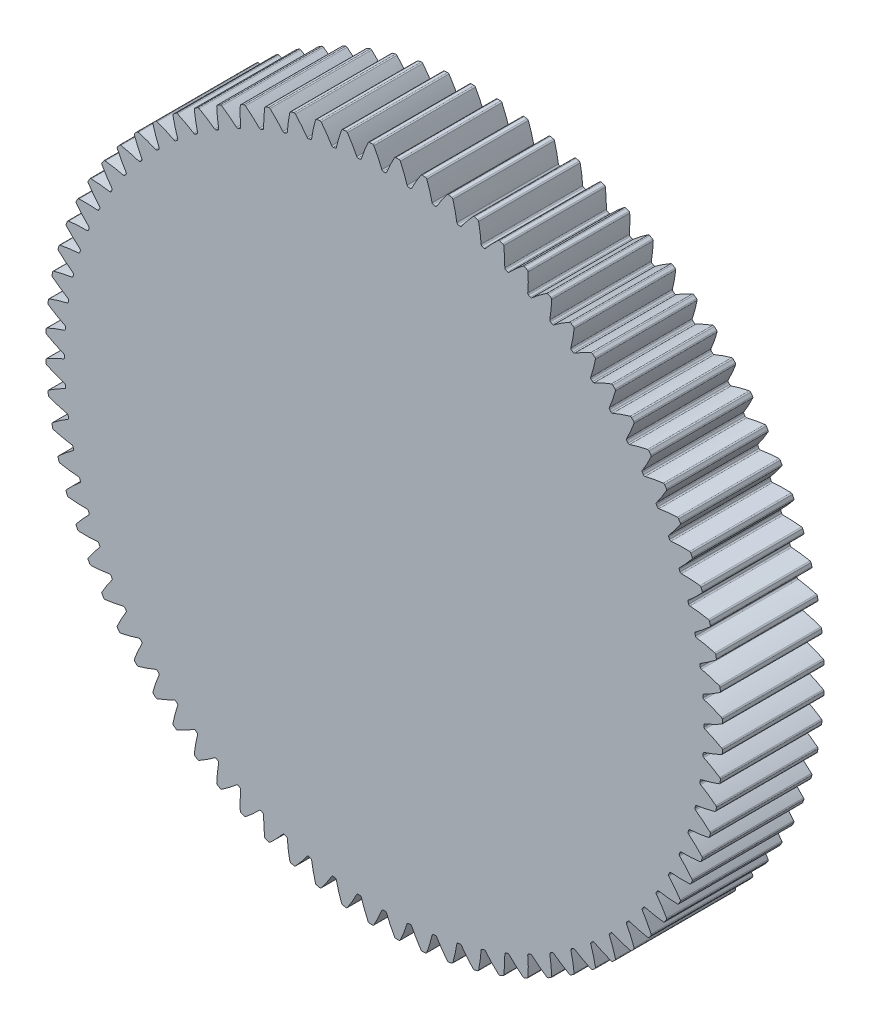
SolidWorks part; units mm, degrees
ref_plane "Front" through (0, 0, 0) normal (0, 0, 1) x (1, 0, 0)
ref_plane "Top" through (0, 0, 0) normal (0, 1, 0) x (1, 0, 0)
ref_plane "Right" through (0, 0, 0) normal (1, 0, 0) x (0, 0, -1)
sketch "Sketch1" plane through (0, 0, 0) normal (0, 0, 1) x (1, 0, 0)
  circle A0 centre (0, 0) radius 42.3069
extrude "Boss-Extrude1" add sketch "Sketch1" along normal blind 12.7
sketch "Sketch3" plane through (0, 0, 0) normal (0, 0, 1) x (1, 0, 0)
  line L0 (0, 0) -> (43.7181, 0) construction
  line L2 (0, 0) -> (0.4135, 39.983) construction
  line L3 (0, 0) -> (-0.4135, 39.983) construction
  line L4 (-0.4135, 39.983) -> (-0.3868, 37.4059) construction
  line L5 (0, 0) -> (0, 61.276) construction
  line L6 (0.4135, 39.983) -> (0.3868, 37.4059) construction
  circle A0 centre (0, 0) radius 42.3069 construction
  circle A1 centre (0, 0) radius 41.275 construction
  circle A2 centre (0, 0) radius 37.4079 construction
  arc A3 (-0.4135, 39.983) -> (0.4135, 39.983) centre (0, 0) ccw construction
  arc A5 (1.3504, 42.2853) -> (-1.3504, 42.2853) centre (0, 0) ccw
  spline S0 degree 4 poles (0.3868, 37.4059) (0.3868, 37.4136) (0.3865, 37.4352) (0.3849, 37.4762) (0.3808, 37.5429) (0.3734, 37.628) (0.3613, 37.7379) (0.3437, 37.8673) (0.321, 38.0094) (0.2927, 38.1638) (0.2611, 38.3177) (0.2266, 38.4711) (0.1895, 38.6237) (0.1414, 38.8083) (0.0791, 39.0294) (-0.0001, 39.2873) (-0.0977, 39.5791) (-0.2054, 39.8758) (-0.3181, 40.167) (-0.4397, 40.4603) (-0.5629, 40.7436) (-0.6987, 41.0368) (-0.8281, 41.307) (-0.9819, 41.6086) (-1.1086, 41.8517) (-1.2849, 42.1709) (-1.3919, 42.3591) (-1.5203, 42.5789) (-1.579, 42.6762) (-1.6151, 42.7361) knots 0 0 0 0 0 0.005377 0.015084 0.028532 0.04661 0.064855 0.092111 0.119476 0.146842 0.174209 0.201575 0.228941 0.256307 0.307035 0.361767 0.4165 0.471232 0.525964 0.580697 0.635429 0.690161 0.744894 0.799626 0.854358 0.909091 0.954545 1 1 1 1 1 construction
  spline S1 degree 4 poles (0.3868, 37.4059) (0.3868, 37.4136) (0.3865, 37.4352) (0.3849, 37.4762) (0.3808, 37.5429) (0.3734, 37.628) (0.3613, 37.7379) (0.3437, 37.8673) (0.321, 38.0094) (0.2927, 38.1638) (0.2611, 38.3177) (0.2266, 38.4711) (0.1895, 38.6237) (0.1414, 38.8083) (0.0791, 39.0294) (-0.0001, 39.2873) (-0.0977, 39.5791) (-0.2054, 39.8758) (-0.3181, 40.167) (-0.4397, 40.4603) (-0.5629, 40.7436) (-0.6987, 41.0368) (-0.8281, 41.307) (-0.9819, 41.6086) (-1.1086, 41.8517) (-1.2467, 42.1017) (-1.315, 42.2233) (-1.3504, 42.2853) knots 0 0 0 0 0 0.005377 0.015084 0.028532 0.04661 0.064855 0.092111 0.119476 0.146842 0.174209 0.201575 0.228941 0.256307 0.307035 0.361767 0.4165 0.471232 0.525964 0.580697 0.635429 0.690161 0.744894 0.799626 0.854358 0.909091 0.909091 0.909091 0.909091 0.909091
  spline S2 degree 4 poles (-0.3868, 37.4059) (-0.3868, 37.4136) (-0.3865, 37.4352) (-0.3849, 37.4762) (-0.3808, 37.5429) (-0.3734, 37.628) (-0.3613, 37.7379) (-0.3437, 37.8673) (-0.321, 38.0094) (-0.2927, 38.1638) (-0.2611, 38.3177) (-0.2266, 38.4711) (-0.1895, 38.6237) (-0.1414, 38.8083) (-0.0791, 39.0294) (0.0001, 39.2873) (0.0977, 39.5791) (0.2054, 39.8758) (0.3181, 40.167) (0.4397, 40.4603) (0.5629, 40.7436) (0.6987, 41.0368) (0.8281, 41.307) (0.9819, 41.6086) (1.1086, 41.8517) (1.2849, 42.1709) (1.3919, 42.3591) (1.5203, 42.5789) (1.579, 42.6762) (1.6151, 42.7361) knots 0 0 0 0 0 0.005377 0.015084 0.028532 0.04661 0.064855 0.092111 0.119476 0.146842 0.174209 0.201575 0.228941 0.256307 0.307035 0.361767 0.4165 0.471232 0.525964 0.580697 0.635429 0.690161 0.744894 0.799626 0.854358 0.909091 0.954545 1 1 1 1 1 construction
  spline S3 degree 4 poles (-0.3868, 37.4059) (-0.3868, 37.4136) (-0.3865, 37.4352) (-0.3849, 37.4762) (-0.3808, 37.5429) (-0.3734, 37.628) (-0.3613, 37.7379) (-0.3437, 37.8673) (-0.321, 38.0094) (-0.2927, 38.1638) (-0.2611, 38.3177) (-0.2266, 38.4711) (-0.1895, 38.6237) (-0.1414, 38.8083) (-0.0791, 39.0294) (0.0001, 39.2873) (0.0977, 39.5791) (0.2054, 39.8758) (0.3181, 40.167) (0.4397, 40.4603) (0.5629, 40.7436) (0.6987, 41.0368) (0.8281, 41.307) (0.9819, 41.6086) (1.1086, 41.8517) (1.2467, 42.1017) (1.315, 42.2233) (1.3504, 42.2853) knots 0 0 0 0 0 0.005377 0.015084 0.028532 0.04661 0.064855 0.092111 0.119476 0.146842 0.174209 0.201575 0.228941 0.256307 0.307035 0.361767 0.4165 0.471232 0.525964 0.580697 0.635429 0.690161 0.744894 0.799626 0.854358 0.909091 0.909091 0.909091 0.909091 0.909091
  point P0 (0, -39.9852)
sketch "DCLTBC" [suppressed] plane through (0, 0, 0) normal (0, 0, 1) x (1, 0, 0)
  line L0 (0, 0) -> (41.04, 0) construction
  line L1 (-16.5988, 341.5199) -> (-17.1927, 353.7396) construction
  line L2 (16.5988, 341.5199) -> (17.1927, 353.7396) construction
  line L3 (-16.5988, 341.5199) -> (-17.1927, 353.7396)
  line L4 (16.5988, 341.5199) -> (17.1927, 353.7396)
  line L5 (0, 0) -> (0, 104.9356) construction
  circle A0 centre (0, 0) radius 429.8462
  circle A1 centre (0, 0) radius 390.7692 construction
  circle A2 centre (0, 0) radius 354.1572 construction
  arc A3 (16.5988, 341.5199) -> (-16.5988, 341.5199) centre (0, 0) ccw construction
  arc A4 (16.5988, 341.5199) -> (-16.5988, 341.5199) centre (0, 0) ccw
  spline S0 degree 4 poles (-1014.6631, 283.0439) (-47.6852, 335.8844) (-17.293, 343.3327) (-16.5403, 349.5311) (-17.4538, 355.9262) (-17.693, 357.2758) (-18.0546, 359.0133) (-18.5477, 361.0502) (-19.1599, 363.2771) (-19.9008, 365.6854) (-20.7071, 368.0753) (-21.5719, 370.4445) (-22.4903, 372.7935) (-23.665, 375.6195) (-25.1689, 378.9903) (-27.0474, 382.8826) (-29.347, 387.2688) (-31.8293, 391.6605) (-34.4404, 395.9766) (-36.8296, 399.688) (-38.9472, 402.8229) (-40.7561, 405.4047) (-42.229, 407.452) (-44.1012, 409.9882) (-46.0141, 412.4944) (-47.9652, 414.9702) (-49.954, 417.4168) (-51.5659, 419.3552) (-52.9965, 421.0377) (-54.2324, 422.4653) (-55.2776, 423.6552) (-58.4723, 427.2561) (-63.5875, 432.7944) (-33.3353, 399.1791) (-729.2796, 1166.5662) knots -0.233759 -0.233759 -0.233759 -0.233759 -0.233759 0.005377 0.015084 0.028532 0.04661 0.064855 0.092111 0.119476 0.146842 0.174209 0.201575 0.228941 0.256307 0.307035 0.361767 0.4165 0.471232 0.525964 0.580697 0.608063 0.635429 0.662795 0.690161 0.744894 0.77226 0.799626 0.826992 0.854358 0.868042 0.881725 0.895408 1.068789 1.068789 1.068789 1.068789 1.068789 only from (-17.1927, 353.7396) to (-57.3769, 425.9995) construction
  spline S1 degree 4 poles (1014.6631, 283.0439) (47.6852, 335.8844) (17.293, 343.3327) (16.5403, 349.5311) (17.4538, 355.9262) (17.693, 357.2758) (18.0546, 359.0133) (18.5477, 361.0502) (19.1599, 363.2771) (19.9008, 365.6854) (20.7071, 368.0753) (21.5719, 370.4445) (22.4903, 372.7935) (23.665, 375.6195) (25.1689, 378.9903) (27.0474, 382.8826) (29.347, 387.2688) (31.8293, 391.6605) (34.4404, 395.9766) (36.8296, 399.688) (38.9472, 402.8229) (40.7561, 405.4047) (42.229, 407.452) (44.1012, 409.9882) (46.0141, 412.4944) (47.9652, 414.9702) (49.954, 417.4168) (51.5659, 419.3552) (52.9965, 421.0377) (54.2324, 422.4653) (55.2776, 423.6552) (58.4723, 427.2561) (63.5875, 432.7944) (33.3353, 399.1791) (729.2796, 1166.5662) knots -0.233759 -0.233759 -0.233759 -0.233759 -0.233759 0.005377 0.015084 0.028532 0.04661 0.064855 0.092111 0.119476 0.146842 0.174209 0.201575 0.228941 0.256307 0.307035 0.361767 0.4165 0.471232 0.525964 0.580697 0.608063 0.635429 0.662795 0.690161 0.744894 0.77226 0.799626 0.826992 0.854358 0.868042 0.881725 0.895408 1.068789 1.068789 1.068789 1.068789 1.068789 only from (17.1927, 353.7396) to (57.3769, 425.9995) construction
  spline S2 degree 4 poles (-17.1927, 353.7396) (-17.2005, 353.8633) (-17.228, 354.2097) (-17.302, 354.863) (-17.4538, 355.9262) (-17.693, 357.2758) (-18.0546, 359.0133) (-18.5477, 361.0502) (-19.1599, 363.2771) (-19.9008, 365.6854) (-20.7071, 368.0753) (-21.5719, 370.4445) (-22.4903, 372.7935) (-23.665, 375.6195) (-25.1689, 378.9903) (-27.0474, 382.8826) (-29.347, 387.2688) (-31.8293, 391.6605) (-34.4404, 395.9766) (-36.8296, 399.688) (-38.9472, 402.8229) (-40.7561, 405.4047) (-42.229, 407.452) (-44.1012, 409.9882) (-46.0141, 412.4944) (-47.9652, 414.9702) (-49.954, 417.4168) (-51.5659, 419.3552) (-52.9965, 421.0377) (-54.2324, 422.4653) (-55.2776, 423.6552) (-56.0931, 424.5743) (-56.7935, 425.3543) (-57.1845, 425.7872) (-57.3769, 425.9995) knots 0 0 0 0 0 0.005377 0.015084 0.028532 0.04661 0.064855 0.092111 0.119476 0.146842 0.174209 0.201575 0.228941 0.256307 0.307035 0.361767 0.4165 0.471232 0.525964 0.580697 0.608063 0.635429 0.662795 0.690161 0.744894 0.77226 0.799626 0.826992 0.854358 0.868042 0.881725 0.895408 0.909091 0.909091 0.909091 0.909091 0.909091
  spline S3 degree 4 poles (17.1927, 353.7396) (17.2005, 353.8633) (17.228, 354.2097) (17.302, 354.863) (17.4538, 355.9262) (17.693, 357.2758) (18.0546, 359.0133) (18.5477, 361.0502) (19.1599, 363.2771) (19.9008, 365.6854) (20.7071, 368.0753) (21.5719, 370.4445) (22.4903, 372.7935) (23.665, 375.6195) (25.1689, 378.9903) (27.0474, 382.8826) (29.347, 387.2688) (31.8293, 391.6605) (34.4404, 395.9766) (36.8296, 399.688) (38.9472, 402.8229) (40.7561, 405.4047) (42.229, 407.452) (44.1012, 409.9882) (46.0141, 412.4944) (47.9652, 414.9702) (49.954, 417.4168) (51.5659, 419.3552) (52.9965, 421.0377) (54.2324, 422.4653) (55.2776, 423.6552) (56.0931, 424.5743) (56.7935, 425.3543) (57.1845, 425.7872) (57.3769, 425.9995) knots 0 0 0 0 0 0.005377 0.015084 0.028532 0.04661 0.064855 0.092111 0.119476 0.146842 0.174209 0.201575 0.228941 0.256307 0.307035 0.361767 0.4165 0.471232 0.525964 0.580697 0.608063 0.635429 0.662795 0.690161 0.744894 0.77226 0.799626 0.826992 0.854358 0.868042 0.881725 0.895408 0.909091 0.909091 0.909091 0.909091 0.909091
extrude "Cut-Extrude-DCLTBC" [suppressed] cut sketch "DCLTBC" along normal through all
fillet "Fillet-Tip-DCLTBC" [suppressed] radius 0.1835
fillet "Fillet-Root-DCLTBC" [suppressed] radius 0.367
pattern_circular "CirPattern-DCLTBC" [suppressed] count 80 over 360
sketch "DCGTBC" plane through (0, 0, 0) normal (0, 0, 1) x (1, 0, 0)
  line L0 (0, 0) -> (41.04, 0) construction
  line L1 (-39.833, 3.4849) -> (0, 0) construction
  line L2 (0, 0) -> (39.833, 3.4849) construction
  line L3 (0, 0) -> (-16.5124, 0)
  line L5 (0, 0) -> (0, 104.9356) construction
  circle A0 centre (0, 0) radius 42.3069
  circle A1 centre (0, 0) radius 41.275 construction
  circle A2 centre (0, 0) radius 37.4079 construction
  arc A3 (-0.4135, 39.983) -> (0.4135, 39.983) centre (0, 0) ccw construction
  arc A11 (39.833, 3.4849) -> (-39.833, 3.4849) centre (0, 0) ccw
  spline S4 degree 4 poles (999.5082, 24.1126) (13.6231, 35.3302) (-0.1447, 35.9376) (-0.4303, 36.7368) (-0.3808, 37.5429) (-0.3734, 37.628) (-0.3613, 37.7379) (-0.3437, 37.8673) (-0.321, 38.0094) (-0.2927, 38.1638) (-0.2611, 38.3177) (-0.2266, 38.4711) (-0.1895, 38.6237) (-0.1414, 38.8083) (-0.0791, 39.0294) (0.0001, 39.2873) (0.0977, 39.5791) (0.2054, 39.8758) (0.3181, 40.167) (0.4397, 40.4603) (0.5629, 40.7436) (0.6987, 41.0368) (0.8281, 41.307) (0.9819, 41.6086) (1.5374, 42.6745) (3.3727, 45.74) (-13.9019, 15.1174) (496.7932, 910.9139) knots -0.516008 -0.516008 -0.516008 -0.516008 -0.516008 0.005377 0.015084 0.028532 0.04661 0.064855 0.092111 0.119476 0.146842 0.174209 0.201575 0.228941 0.256307 0.307035 0.361767 0.4165 0.471232 0.525964 0.580697 0.635429 0.690161 0.744894 0.799626 0.854358 1.650265 1.650265 1.650265 1.650265 1.650265 only from (-0.3868, 37.4059) to (1.3504, 42.2853) construction
  spline S5 degree 4 poles (-999.5082, 24.1125) (-13.6231, 35.3302) (0.1447, 35.9376) (0.4303, 36.7368) (0.3808, 37.5429) (0.3734, 37.628) (0.3613, 37.7379) (0.3437, 37.8673) (0.321, 38.0094) (0.2927, 38.1638) (0.2611, 38.3177) (0.2266, 38.4711) (0.1895, 38.6237) (0.1414, 38.8083) (0.0791, 39.0294) (-0.0001, 39.2873) (-0.0977, 39.5791) (-0.2054, 39.8758) (-0.3181, 40.167) (-0.4397, 40.4603) (-0.5629, 40.7436) (-0.6987, 41.0368) (-0.8281, 41.307) (-0.9819, 41.6086) (-1.5374, 42.6745) (-3.3727, 45.74) (13.9019, 15.1174) (-496.7932, 910.9139) knots -0.516008 -0.516008 -0.516008 -0.516008 -0.516008 0.005377 0.015084 0.028532 0.04661 0.064855 0.092111 0.119476 0.146842 0.174209 0.201575 0.228941 0.256307 0.307035 0.361767 0.4165 0.471232 0.525964 0.580697 0.635429 0.690161 0.744894 0.799626 0.854358 1.650265 1.650265 1.650265 1.650265 1.650265 only from (0.3868, 37.4059) to (-1.3504, 42.2853) construction
  spline S6 degree 4 poles (-0.3868, 37.4059) (-0.3868, 37.4136) (-0.3865, 37.4352) (-0.3849, 37.4762) (-0.3808, 37.5429) (-0.3734, 37.628) (-0.3613, 37.7379) (-0.3437, 37.8673) (-0.321, 38.0094) (-0.2927, 38.1638) (-0.2611, 38.3177) (-0.2266, 38.4711) (-0.1895, 38.6237) (-0.1414, 38.8083) (-0.0791, 39.0294) (0.0001, 39.2873) (0.0977, 39.5791) (0.2054, 39.8758) (0.3181, 40.167) (0.4397, 40.4603) (0.5629, 40.7436) (0.6987, 41.0368) (0.8281, 41.307) (0.9819, 41.6086) (1.1086, 41.8517) (1.2467, 42.1017) (1.315, 42.2233) (1.3504, 42.2853) knots 0 0 0 0 0 0.005377 0.015084 0.028532 0.04661 0.064855 0.092111 0.119476 0.146842 0.174209 0.201575 0.228941 0.256307 0.307035 0.361767 0.4165 0.471232 0.525964 0.580697 0.635429 0.690161 0.744894 0.799626 0.854358 0.909091 0.909091 0.909091 0.909091 0.909091
  spline S7 degree 4 poles (0.3868, 37.4059) (0.3868, 37.4136) (0.3865, 37.4352) (0.3849, 37.4762) (0.3808, 37.5429) (0.3734, 37.628) (0.3613, 37.7379) (0.3437, 37.8673) (0.321, 38.0094) (0.2927, 38.1638) (0.2611, 38.3177) (0.2266, 38.4711) (0.1895, 38.6237) (0.1414, 38.8083) (0.0791, 39.0294) (-0.0001, 39.2873) (-0.0977, 39.5791) (-0.2054, 39.8758) (-0.3181, 40.167) (-0.4397, 40.4603) (-0.5629, 40.7436) (-0.6987, 41.0368) (-0.8281, 41.307) (-0.9819, 41.6086) (-1.1086, 41.8517) (-1.2467, 42.1017) (-1.315, 42.2233) (-1.3504, 42.2853) knots 0 0 0 0 0 0.005377 0.015084 0.028532 0.04661 0.064855 0.092111 0.119476 0.146842 0.174209 0.201575 0.228941 0.256307 0.307035 0.361767 0.4165 0.471232 0.525964 0.580697 0.635429 0.690161 0.744894 0.799626 0.854358 0.909091 0.909091 0.909091 0.909091 0.909091
  dimension "D1" = 5
  dimension "D2" = 5
extrude "Cut-Extrude-DCGTBC" cut sketch "DCGTBC" along normal through all
fillet "Fillet-Tip-DCGTBC" radius 0.1835 4 edges at (1.3504, 42.2853, 6.35) (-1.3504, 42.2853, 6.35) (0.2481, 39.9844, 6.35) (-0.2481, 39.9844, 6.35)
pattern_circular "CirPattern-DCGTBC" count 80 over 360 about axis through (0, 0, 12.7) along (0, 0, 1) of "Cut-Extrude-DCGTBC", "Fillet-Tip-DCGTBC"
equation "\"DiametralPitch\" = 80 / 3.25'Diametral Pitch"
equation "\"NumTeeth\"= 16 * 5'Number of Teeth"
equation "\"PressureAngle\"= 25deg'Pressure Angle"
equation "\"Addendum\"= 1 / \"DiametralPitch\"'Addendum"
equation "\"Dedendum\"= 1.25 / \"DiametralPitch\"'Dedendum"
equation "\"WorkingDepth\"= 2 / \"DiametralPitch\"'Working Depth - here for REF (Not used in building model)"
equation "\"WholeDepth\"= 2.25 / \"DiametralPitch\"'Whole Depth - here for REF (Not used in building model)"
equation "\"Clearance\"= .25 / \"DiametralPitch\"'Clearance"
equation "\"CircularPitch\"= pi / \"DiametralPitch\"'Circular Pitch - here for REF (Not used in building model)"
equation "\"PitchCircle\"= \"NumTeeth\" / \"DiametralPitch\"'Pitch Circle - or - Pitch Diameter"
equation "\"OutsideDiameter\"= ( \"NumTeeth\" + 2 ) / \"DiametralPitch\"'Outside Diameter"
equation "\"Fillet_Root\"= \"Clearance\" * cos ( \"PressureAngle\" ) * tan ( ( 90 + \"PressureAngle\" ) / 2 ) 'Fillet Root"
equation "\"AddendumCircle\"= \"PitchCircle\" + ( 2 * \"Addendum\" )'Addendum Circle - or - Addendum Diameter"
equation "\"DedendumCircle\"= \"PitchCircle\" - ( 2 * \"Dedendum\" )'Dedendum Circle - or - Dedendum Diameter"
equation "\"BaseCircle\"= \"PitchCircle\" * cos ( \"PressureAngle\" )'Base Circle - Base Diameter"
equation "\"PitchAngle\"= 360deg / \"NumTeeth\"'Pitch Angle"
equation "\"Alpha\"= sqr ( \"PitchCircle\" ^ 2 - \"BaseCircle\" ^ 2 ) / \"BaseCircle\" * 180 / PI - \"PressureAngle\"'Alpha - Used for Calculating Beta"
equation "\"Beta\"= ( \"PitchAngle\" / 4 - ( \"Alpha\" - 90 ) )'Beta - Used in definition of the parameters for the parametric equation driven curve"
equation "\"Gamma\"= ( \"PitchAngle\" / 4 - ( \"Alpha\" + 90 ) )'Gamma - Used in definition of the parameters for the parametric equation driven curve"
equation "\"Phi\"= sqr ( ( \"AddendumCircle\" / 2 ) ^ 2 - ( \"BaseCircle\" / 2 ) ^ 2 ) / ( \"BaseCircle\" / 2 )'Phi - Used in definition of the parameters for the parametric equation driven curve"
equation "\"DCGTBC\"= iif ( \"DedendumCircle\" > \"BaseCircle\" , \"unsuppressed\" , \"suppressed\" )'if Dedendum Circle IS GREATER THAN BaseCircle THEN UnsuppressORSuppress FEATURE"
equation "\"DCLTBC\"= iif ( \"DedendumCircle\" - .002 > \"BaseCircle\" , \"suppressed\" , \"unsuppressed\" )'if Dedendum Circle - .002 IS GREATER THAN BaseCircle THEN SuppressORUnsuppress FEATURE"
equation "\"Cut-Extrude-DCGTBC\"= iif ( \"DedendumCircle\" > \"BaseCircle\" , \"unsuppressed\" , \"suppressed\" )'if Dedendum Circle IS GREATER THAN BaseCircle THEN UnsuppressORSuppress FEATURE"
equation "\"Cut-Extrude-DCLTBC\"= iif ( \"DedendumCircle\" - .002 > \"BaseCircle\" , \"suppressed\" , \"unsuppressed\" )'if Dedendum Circle - .002 IS GREATER THAN BaseCircle THEN SuppressORUnsuppress FEATURE"
equation "\"CirPattern-DCGTBC\"= iif ( \"DedendumCircle\" > \"BaseCircle\" , \"unsuppressed\" , \"suppressed\" )'if Dedendum Circle IS GREATER THAN BaseCircle THEN UnsuppressORSuppress FEATURE"
equation "\"CirPattern-DCLTBC\"= iif ( \"DedendumCircle\" - .002 > \"BaseCircle\" , \"suppressed\" , \"unsuppressed\" )'if Dedendum Circle - .002 IS GREATER THAN BaseCircle THEN SuppressORUnsuppress FEATURE"
equation "\"Fillet-Tip-DCGTBC\"= iif ( \"DedendumCircle\" > \"BaseCircle\" , \"unsuppressed\" , \"suppressed\" )'if Dedendum Circle IS GREATER THAN BaseCircle THEN UnsuppressORSuppress FEATURE"
equation "\"Fillet-Tip-DCLTBC\"= iif ( \"DedendumCircle\" - .002 > \"BaseCircle\" , \"suppressed\" , \"unsuppressed\" )'if Dedendum Circle - .002 IS GREATER THAN BaseCircle THEN SuppressORUnsuppress FEATURE"
equation "\"Fillet-Root-DCLTBC\"= iif ( \"DedendumCircle\" - .002 > \"BaseCircle\" , \"suppressed\" , \"unsuppressed\" )'if Dedendum Circle - .002 IS GREATER THAN BaseCircle THEN SuppressORUnsuppress FEATURE"
equation "\"D1@CirPattern-DCGTBC\"= \"NumTeeth\"'Number of Teeth"
equation "\"D1@CirPattern-DCLTBC\"= \"NumTeeth\"'Number of Teeth"
equation "\"D1@Fillet-Tip-DCGTBC\"= \"Fillet_Root\" / 2 'Tip Rad For Large No of Teeth"
equation "\"D1@Fillet-Tip-DCLTBC\"=\"Fillet_Root\" / 2'Tip Rad For Small No of Teeth"
equation "\"D1@Fillet-Root-DCLTBC\"= \"Fillet_Root\"'Fillet Root"
